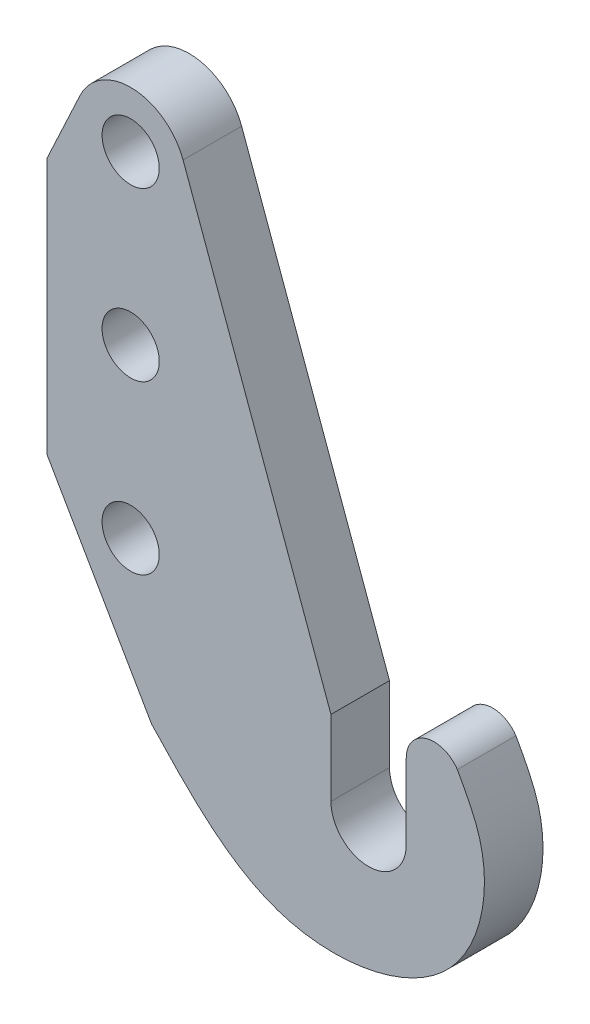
SolidWorks part; units mm, degrees
ref_plane "Plan de face" through (0, 0, 0) normal (0, 0, 1) x (1, 0, 0)
ref_plane "Plan de dessus" through (0, 0, 0) normal (0, 1, 0) x (1, 0, 0)
ref_plane "Plan de droite" through (0, 0, 0) normal (1, 0, 0) x (0, 0, -1)
sketch "Esquisse1" plane through (0, 0, 0) normal (0, 0, 1) x (1, 0, 0)
  line L0 (-30, -17.0112) -> (-30, -109.0112)
  line L1 (-18.1262, 8.4524) -> (-30, -17.0112)
  line L2 (18.7939, 6.8404) -> (71.807, -138.812)
  line L3 (0, 0) -> (0, -126.5937) construction
  line L4 (-30, -109.0112) -> (7.5, -173.9631)
  line L5 (71.807, -138.812) -> (71.807, -165.812)
  line L6 (98.807, -138.812) -> (98.807, -165.812)
  circle A0 centre (0, 0) radius 10.25
  arc A1 (18.7939, 6.8404) -> (-18.1262, 8.4524) centre (0, 0) ccw
  circle A2 centre (0, -60) radius 10.25
  circle A3 centre (0, -120) radius 10.25
  arc A4 (71.807, -165.812) -> (98.807, -165.812) centre (85.307, -165.812) ccw
  arc A5 (117.1218, -133.2565) -> (98.807, -138.812) centre (108.807, -138.812) ccw
  point P20 (56.3671, -210.2706)
  point P21 (115.7669, -194.7594)
  point P22 (125.3434, -151.545)
  dimension "D1" = 20.5
  dimension "D2" = 40
  dimension "D8" = 20.5
  dimension "D10" = 20.5
  dimension "D14" = 27
  dimension "D17" = 20
  dimension "D3" = 30
  dimension "D4" = 155
  dimension "D5" = 45
  dimension "D6" = 92
  dimension "D7" = 155
  dimension "D9" = 60
  dimension "D11" = 60
  dimension "D12" = 150
  dimension "D13" = 75
  dimension "D18" = 27
extrude "Extrusion1" add sketch "Esquisse1" along normal blind 21
